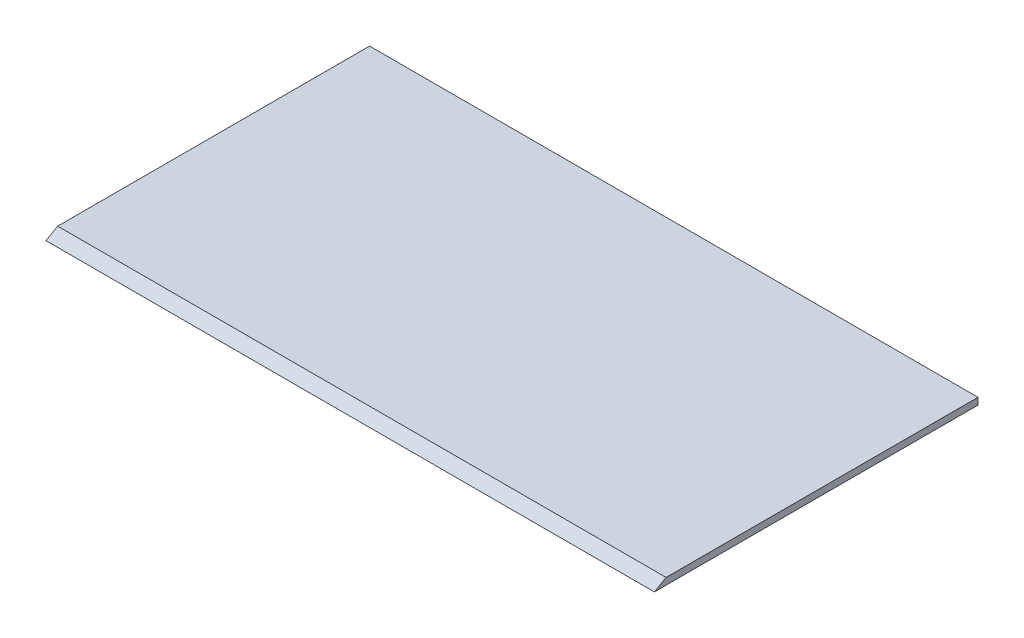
SolidWorks part; units mm, degrees
ref_plane "Front Plane" through (0, 0, 0) normal (0, 0, 1) x (1, 0, 0)
ref_plane "Top Plane" through (0, 0, 0) normal (0, 1, 0) x (1, 0, 0)
ref_plane "Right Plane" through (0, 0, 0) normal (1, 0, 0) x (0, 0, -1)
sketch "Sketch1" plane through (0, 0, 0) normal (0, 1, 0) x (1, 0, 0)
  line L1 (-573.0875, -304.8) -> (573.0875, -304.8)
  line L2 (-573.0875, -304.8) -> (-573.0875, 304.8)
  line L3 (-573.0875, 304.8) -> (573.0875, 304.8)
  line L4 (573.0875, -304.8) -> (573.0875, 304.8)
  line L5 (-573.0875, -304.8) -> (573.0875, 304.8) construction
  line L6 (-573.0875, 304.8) -> (573.0875, -304.8) construction
  point P0 (0, 0)
  dimension "D1" = 1146.175
  dimension "D2" = 609.6
extrude "Extrude1" add sketch "Sketch1" along normal mid plane 12.7
sketch "Sketch2" plane through (573.0875, 0, 0) normal (1, 0, 0) x (0, 0, -1)
  line L0 (-304.8, -6.35) -> (-282.803, 6.35)
  line L4 (-304.8, -6.35) -> (304.8, -6.35)
  line L5 (304.8, -6.35) -> (304.8, 6.35)
  line L6 (304.8, 6.35) -> (-304.8, 6.35)
  line L7 (-304.8, 6.35) -> (-304.8, -6.35)
  line L8 (-304.8, -6.35) -> (304.8, -6.35)
  line L9 (304.8, -6.35) -> (304.8, 6.35)
  line L10 (304.8, 6.35) -> (-304.8, 6.35)
  line L11 (-304.8, 6.35) -> (-304.8, -6.35)
  dimension "D2" = 30
  dimension "D1" = 0
extrude "Extrude2" cut sketch "Sketch2" against normal through all contours L0 M8 M7
